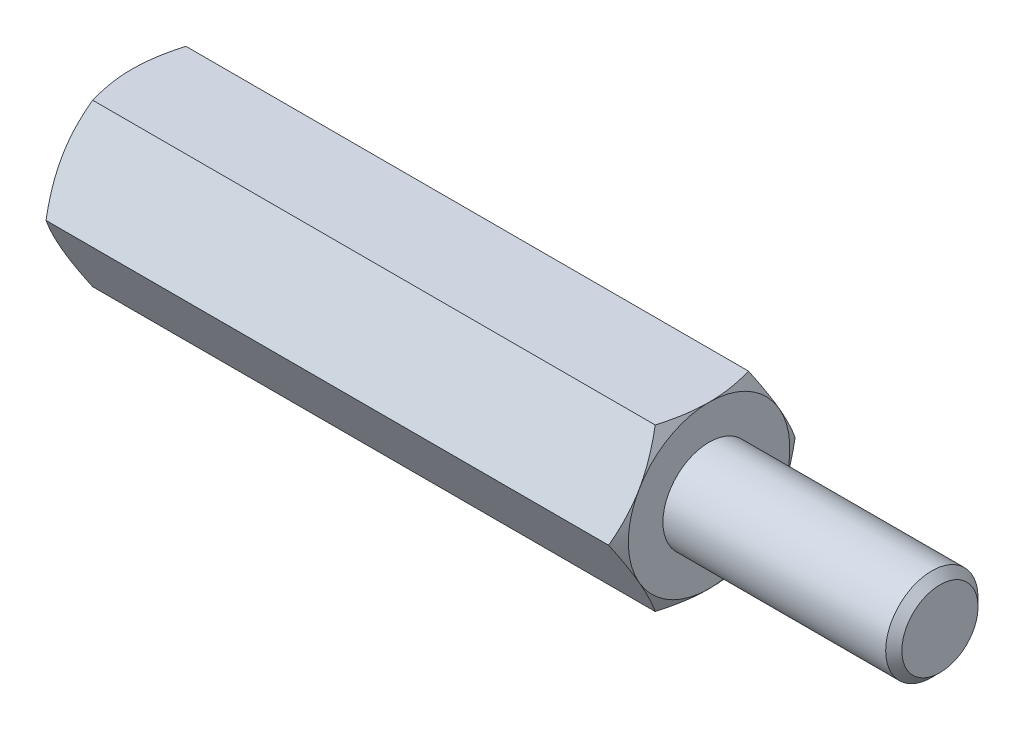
SolidWorks part; units mm, degrees
ref_plane "Front Plane" through (0, 0, 0) normal (0, 0, 1) x (1, 0, 0)
ref_plane "Top Plane" through (0, 0, 0) normal (0, 1, 0) x (1, 0, 0)
ref_plane "Right Plane" through (0, 0, 0) normal (1, 0, 0) x (0, 0, -1)
sketch "Sketch1" plane through (0, 0, 0) normal (1, 0, 0) x (0, 0, -1)
  line L1 (2.0207, 3.5) -> (-2.0207, 3.5)
  line L2 (-2.0207, 3.5) -> (-4.0415, 0)
  line L3 (-4.0415, 0) -> (-2.0207, -3.5)
  line L4 (-2.0207, -3.5) -> (2.0207, -3.5)
  line L5 (2.0207, -3.5) -> (4.0415, 0)
  line L6 (4.0415, 0) -> (2.0207, 3.5)
  circle A0 centre (0, 0) radius 3.5 construction
  dimension "D1" = 7
extrude "Extrude2" add sketch "Sketch1" along normal mid plane 25
sketch "Sketch2" plane through (0, 0, 0) normal (0, 0, 1) x (1, 0, 0)
  line L0 (-12.5, 3.5) -> (-11, 6.0981)
  line L1 (-12.5, 6.5) -> (-12.5, 3.5)
  line L3 (0, 0) -> (50000, 0) construction
  arc A0 (-11, 6.0981) -> (-12.5, 6.5) centre (-11.6962, 6.5) ccw
  dimension "D1" = 30
  dimension "D2" = 3
revolve "Cut-Revolve1" cut sketch "Sketch2" angle 360 about L3
mirror "Mirror1" about plane through (0, 0, 0) normal (1, 0, 0) of "Cut-Revolve1"
sketch "Sketch3" plane through (-12.5, 0, 0) normal (-1, 0, 0) x (0, 0, 1)
  circle A0 centre (0, 0) radius 1.65
  dimension "D1" = 3.3
extrude "Extrude3" cut sketch "Sketch3" against normal blind 10
sketch "Sketch4" plane through (0, 0, 0) normal (0, 0, 1) x (1, 0, 0)
  line L0 (-2.5, 0) -> (-2.5, 1.65)
  line L1 (12.1874, 0) -> (-12.1874, 0) construction
  line L2 (-2.5, 1.65) -> (-1.5474, 0)
  line L3 (-1.5474, 0) -> (-2.5, 0)
  line L4 (-12.5, 1.75) -> (-12.5, -1.75) construction
  point P4 (-12.5, 0)
  dimension "D1" = 30
  dimension "D2" = 1.65
  dimension "D3" = 10
revolve "Cut-Revolve2" cut sketch "Sketch4" angle 360 about L3
sketch "Sketch5" plane through (12.5, 0, 0) normal (1, 0, 0) x (0, 0, -1)
  circle A0 centre (0, 0) radius 2
  dimension "D1" = 4
extrude "Extrude4" add sketch "Sketch5" along normal blind 10
chamfer "Chamfer1" distance 0.35 angle 45 1 edges at (22.5, 0, -2)
equation "\"D2@Sketch4\" = \"D1@Sketch3\"/2"
